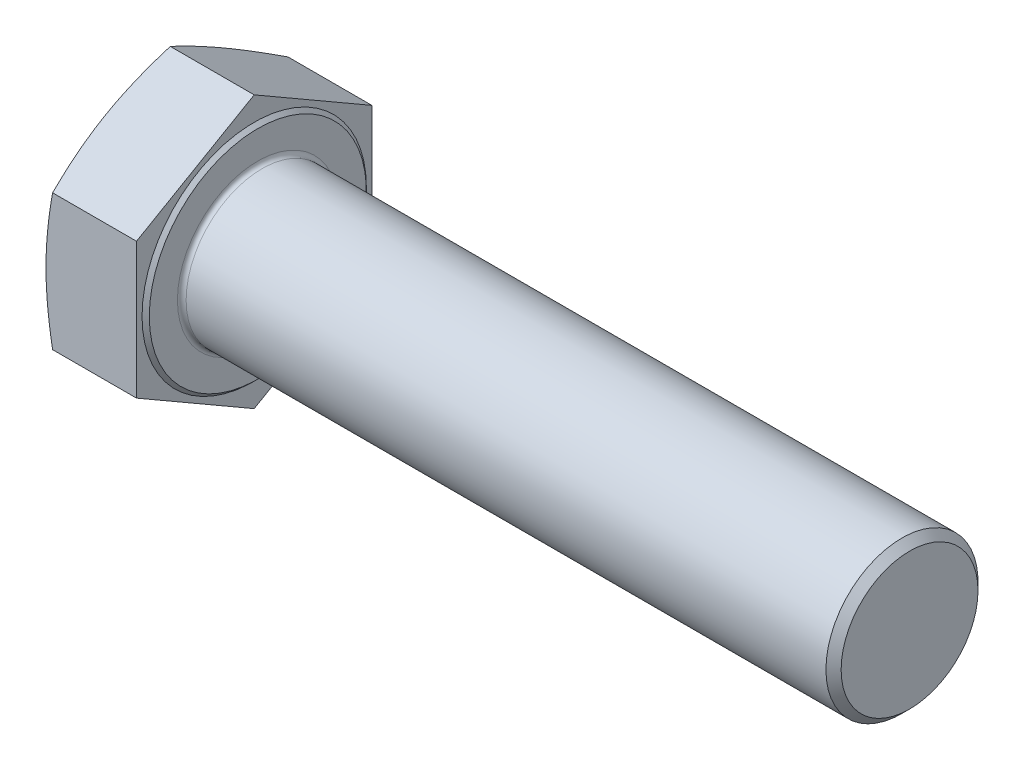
SolidWorks part; units mm, degrees
ref_plane "Front" through (0, 0, 0) normal (0, 0, 1) x (1, 0, 0)
ref_plane "Top" through (0, 0, 0) normal (0, 1, 0) x (1, 0, 0)
ref_plane "Right" through (0, 0, 0) normal (1, 0, 0) x (0, 0, -1)
sketch "Sketch2" plane through (0, 0, 0) normal (1, 0, 0) x (0, 0, -1)
  line L1 (0, -37.5278) -> (32.5, -18.7639)
  line L2 (32.5, -18.7639) -> (32.5, 18.7639)
  line L3 (32.5, 18.7639) -> (0, 37.5278)
  line L4 (0, 37.5278) -> (-32.5, 18.7639)
  line L5 (-32.5, 18.7639) -> (-32.5, -18.7639)
  line L6 (-32.5, -18.7639) -> (0, -37.5278)
  circle A0 centre (0, 0) radius 32.5 construction
  dimension "s" = 65
extrude "BaseHead" add sketch "Sketch2" along normal blind 26
sketch "Sketch3" plane through (0, 0, 0) normal (0, 0, 1) x (1, 0, 0)
  line L0 (26, 37.5278) -> (26, 29.975)
  line L2 (26, 29.975) -> (25, 30.975)
  line L3 (25, 30.975) -> (25, 37.5278)
  line L5 (25, 37.5278) -> (26, 37.5278)
  line L6 (-0.9571, 0) -> (7.6478, 0) construction
  line L7 (26, 37.5278) -> (0, 37.5278) construction
  dimension "D1" = 45
  dimension "c" = 1
  dimension "dw" = 59.95
revolve "BearingFace" cut sketch "Sketch3" angle 360 about L6
sketch "Sketch4" plane through (0, 0, 0) normal (0, 0, 1) x (1, 0, 0)
  line L0 (-0.4935, 0) -> (3.5626, 0) construction
  line L2 (0, 37.5278) -> (1.83, 37.5278)
  line L4 (1.83, 37.5278) -> (0, 32.5)
  line L6 (0, 32.5) -> (0, 37.5278)
  line L7 (25, 37.5278) -> (0, 37.5278) construction
  dimension "D1" = 20
  dimension "D2" = 65
revolve "HeadChamfer" cut sketch "Sketch4" angle 360 about L0
ref_plane "Plane1" through (110, 0, 0) normal (1, 0, 0) x (0, 0, -1)
sketch "Sketch5" plane through (26, 0, 0) normal (1, 0, 0) x (0, 0, -1)
  circle A0 centre (0, 0) radius 21
  dimension "d" = 42
extrude "BaseBody" add sketch "Sketch5" along normal blind 180
chamfer "Chamfer1" distance 2.1 angle 45 1 edges at (206, 0, -21)
fillet "HeadFillet" radius 1.2 1 edges at (26, 0, 21)
equation "\"D2@Sketch4\" = \"s@Sketch2\""
equation "\"D1@Chamfer1\" = 0.05 * \"d@Sketch5\""
equation "\"D1@ThreadCosmetic1\" = \"l@BaseBody\" - \"lg@Plane1\""
